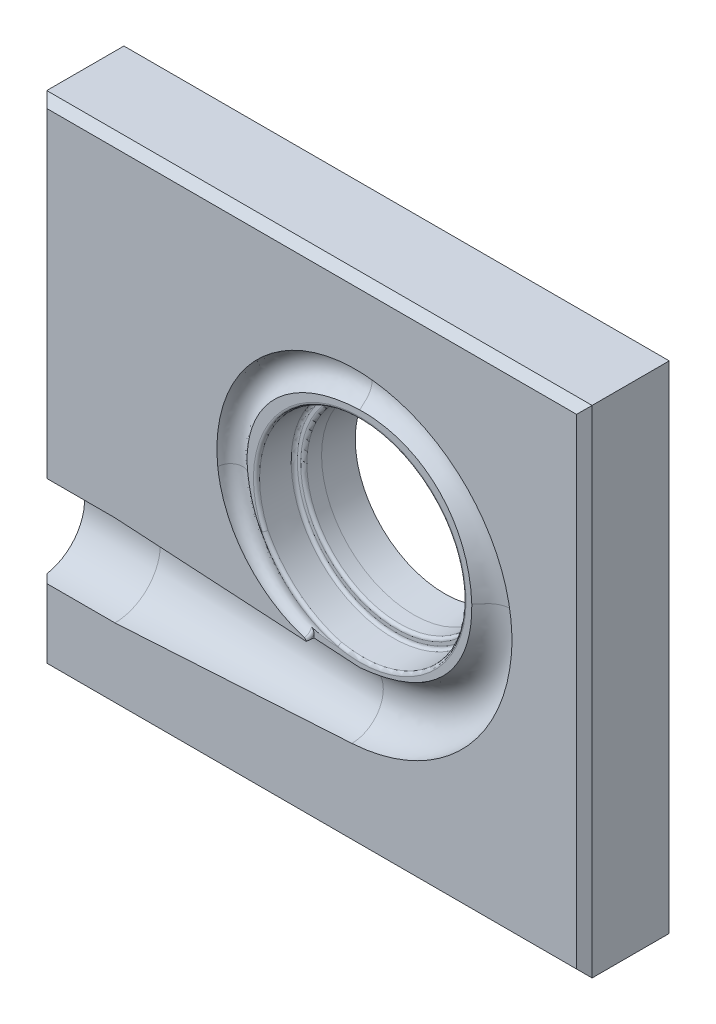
SolidWorks part; units mm, degrees
ref_plane "Plan de face" through (0, 0, 0) normal (0, 0, 1) x (1, 0, 0)
ref_plane "Plan de dessus" through (0, 0, 0) normal (0, 1, 0) x (1, 0, 0)
ref_plane "Plan de droite" through (0, 0, 0) normal (1, 0, 0) x (0, 0, -1)
sketch "Esquisse2" plane through (0, 0, 0) normal (0, 0, 1) x (1, 0, 0)
  line L0 (150, -170) -> (-201.9114, -170) construction
  line L1 (150, 150) -> (-201.9114, 150)
  line L2 (150, 150) -> (150, -170)
  line L3 (150, -170) -> (-201.9114, -170)
  line L4 (-201.9114, 150) -> (-201.9114, -170)
  line L5 (-201.9114, -170) -> (-201.9114, 150) construction
extrude "Extrusion1" add sketch "Esquisse2" against normal up to surface (59.7829 mm away)
other "Empreinte1"
other "NOYAU<1>@E D M1"
chamfer "Chanfrein2" distance 5 angle 45 9 edges at (150, -10, -59.7829) (-25.9557, -170, -59.7829) (-201.9114, -10, -59.7829) (-25.9557, 150, -59.7829) (-201.9114, -145.2532, 0) (-201.9114, 44.1139, 0) (-25.9557, -170, 0) (150, -10, 0) (-25.9557, 150, 0)
